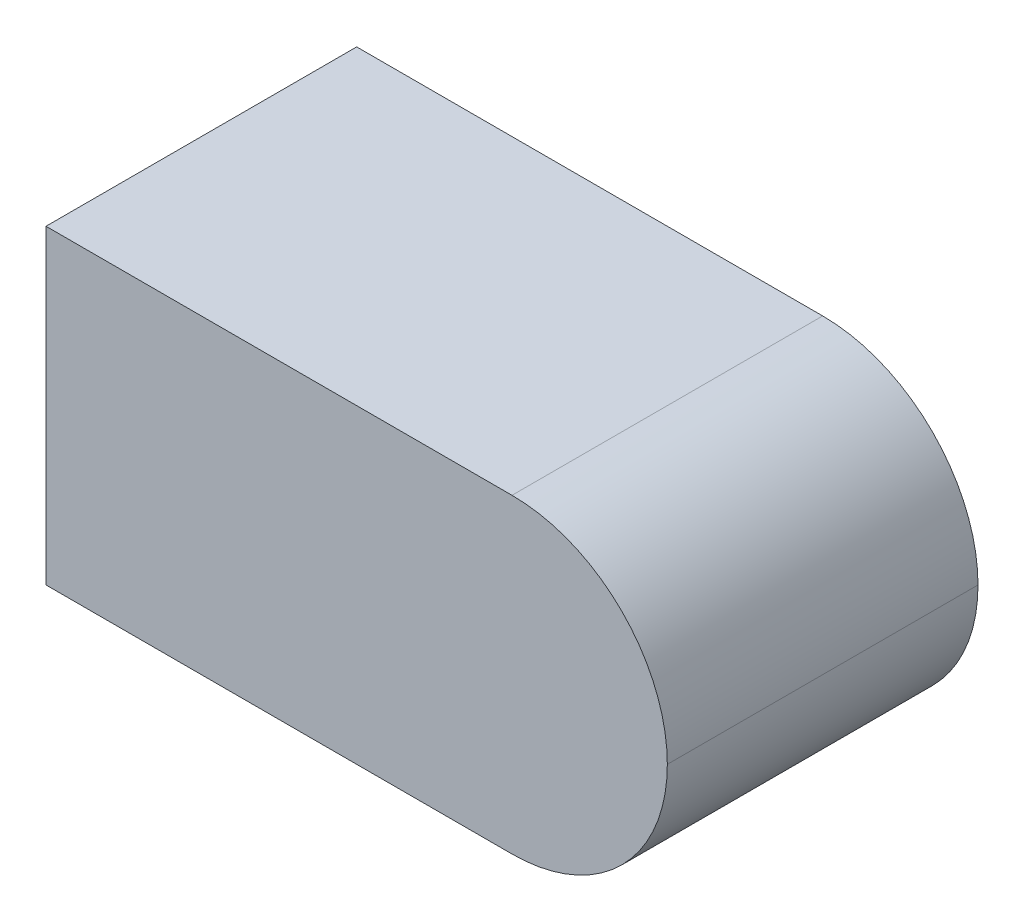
SolidWorks part; units mm, degrees
ref_plane "Front Plane" through (0, 0, 0) normal (0, 0, 1) x (1, 0, 0)
ref_plane "Top Plane" through (0, 0, 0) normal (0, 1, 0) x (1, 0, 0)
ref_plane "Right Plane" through (0, 0, 0) normal (1, 0, 0) x (0, 0, -1)
sketch "Sketch1" plane through (0, 0, 0) normal (0, 1, 0) x (1, 0, 0)
  line L1 (0, 0) -> (20, 0)
  line L2 (0, 0) -> (0, 10)
  line L3 (0, 10) -> (20, 10)
  line L4 (20, 0) -> (20, 10)
  dimension "D1" = 10
  dimension "D2" = 20
extrude "Extrude1" add sketch "Sketch1" along normal blind 10
fillet "Fillet1" radius 5 2 edges at (20, 10, -5) (20, 0, -5)
